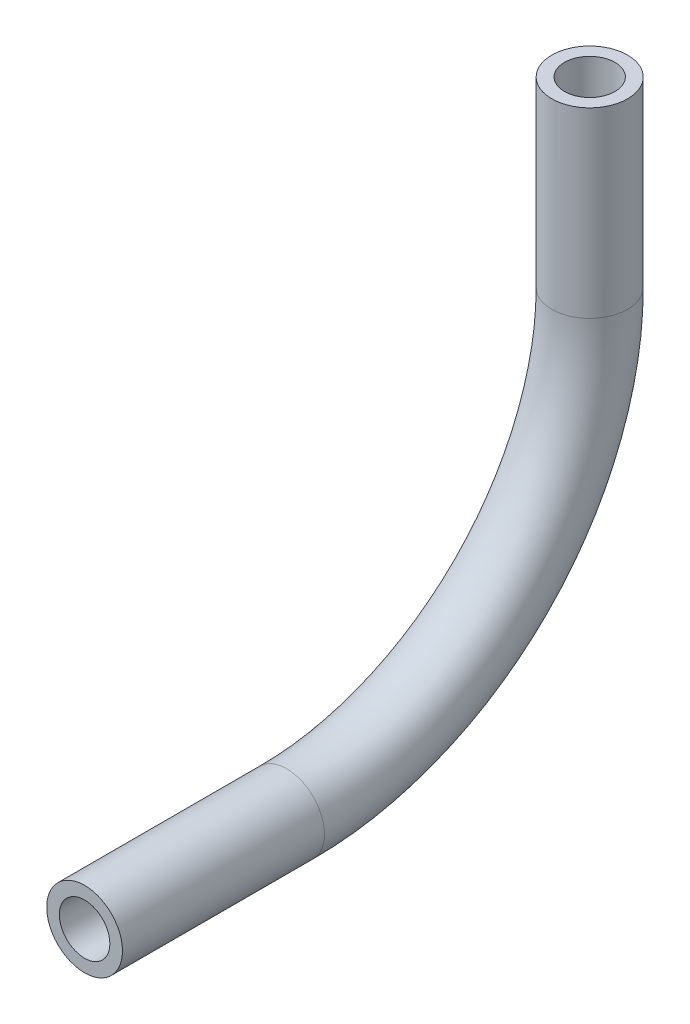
SolidWorks part; units mm, degrees
ref_plane "Front Plane" through (0, 0, 0) normal (0, 0, 1) x (1, 0, 0)
ref_plane "Top Plane" through (0, 0, 0) normal (0, 1, 0) x (1, 0, 0)
ref_plane "Right Plane" through (0, 0, 0) normal (1, 0, 0) x (0, 0, -1)
sketch "Sketch1" plane through (0, 0, 0) normal (0, 0, 1) x (1, 0, 0)
  circle A0 centre (0, 0) radius 9.525
  circle A1 centre (0, 0) radius 6.35
  dimension "D1" = 3.175
  dimension "D2" = 19.05
sketch "Sketch2" plane through (0, 0, 0) normal (1, 0, 0) x (0, 0, -1)
  line L0 (0, 0) -> (50.8, 0)
  line L1 (127, 76.2) -> (127, 122.0506)
  line L2 (194.8793, 160.1506) -> (-741.0419, 160.1506) construction
  arc A0 (50.8, 0) -> (127, 76.2) centre (50.8, 76.2) ccw
  point P6 (127, 0)
  dimension "D3" = 76.2
  dimension "D1" = 50.8
  dimension "D2" = 38.1
sweep "Sweep1" add profiles "Sketch1" path "Sketch2"
